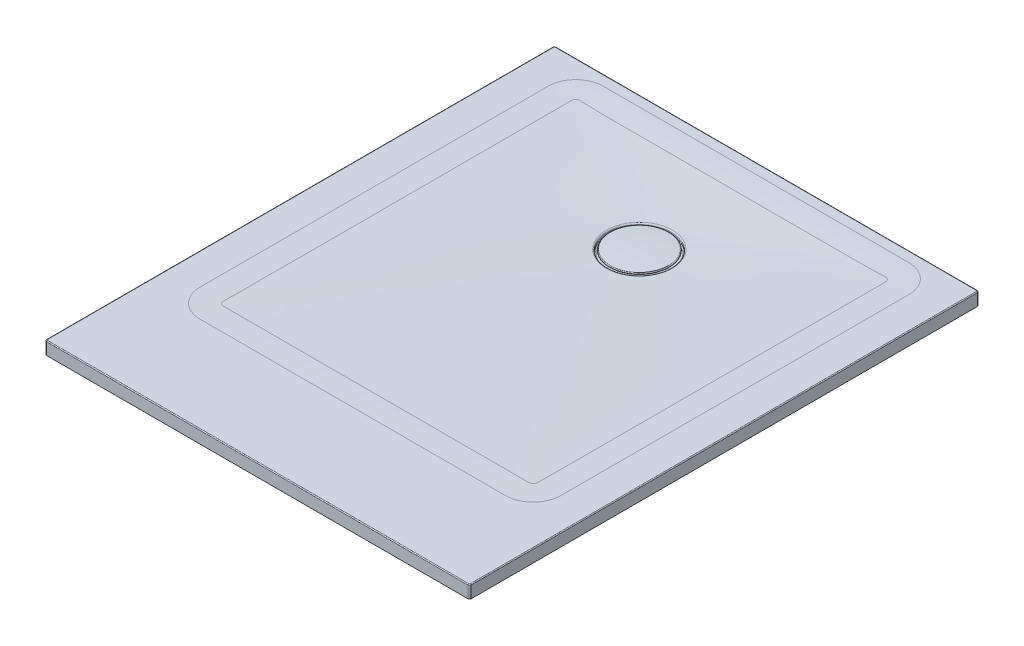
SolidWorks part; units mm, degrees
ref_plane "Płaszczyzna przednia" through (0, 0, 0) normal (0, 0, 1) x (1, 0, 0)
ref_plane "Płaszczyzna górna" through (0, 0, 0) normal (0, 1, 0) x (1, 0, 0)
ref_plane "Płaszczyzna prawa" through (0, 0, 0) normal (1, 0, 0) x (0, 0, -1)
sketch "Szkic2" plane through (0, 0, 0) normal (0, 1, 0) x (1, 0, 0)
  line L0 (0, 600) -> (0, 300) construction
  line L1 (-500, -600) -> (500, -600)
  line L2 (-500, -600) -> (-500, 600)
  line L3 (-500, 600) -> (500, 600)
  line L4 (500, -600) -> (500, 600)
  line L5 (-500, -600) -> (500, 600) construction
  line L6 (-500, 600) -> (500, -600) construction
  line L7 (-410, 560) -> (410, 560)
  line L8 (-410, 560) -> (-410, -360)
  line L9 (-410, -360) -> (410, -360)
  line L10 (410, 560) -> (410, -360)
  line L11 (-450, 600) -> (-450, -400) construction
  line L12 (-450, -400) -> (450, -400) construction
  line L13 (450, -400) -> (450, 600) construction
  circle A0 centre (0, 300) radius 75
  point P0 (0, 0)
  point P11 (0, 560)
  point P16 (0, -400)
  dimension "D9" = 150
  dimension "D1" = 1000
  dimension "D2" = 1200
  dimension "D3" = 40
  dimension "D4" = 90
  dimension "D5" = 40
  dimension "D6" = 50
  dimension "D7" = 1000
  dimension "D8" = 300
  dimension "D10" = 900
sketch "Szkic3" plane through (0, 0, 0) normal (0, 1, 0) x (1, 0, 0)
  line L0 (-500, -600) -> (-500, 600) construction
  line L1 (-500, -600) -> (500, -600) construction
  line L2 (500, -600) -> (500, 600) construction
  line L3 (-500, 600) -> (500, 600) construction
  line L4 (-410, 560) -> (-410, -360) construction
  line L5 (-410, 560) -> (410, 560) construction
  line L6 (410, 560) -> (410, -360) construction
  line L7 (-410, -360) -> (410, -360) construction
  line L8 (-500, -600) -> (-500, 600)
  line L9 (-500, -600) -> (500, -600)
  line L10 (500, -600) -> (500, 600)
  line L11 (-500, 600) -> (500, 600)
  line L12 (-410, 510) -> (-410, -310)
  line L13 (-360, 560) -> (360, 560)
  line L14 (410, 510) -> (410, -310)
  line L15 (-360, -360) -> (360, -360)
  arc A0 (410, 510) -> (360, 560) centre (360, 510) ccw
  arc A1 (-360, 560) -> (-410, 510) centre (-360, 510) ccw
  arc A2 (360, -360) -> (410, -310) centre (360, -310) ccw
  arc A3 (-360, -360) -> (-410, -310) centre (-360, -310) cw
  dimension "D1" = 50
surface "Powierzchnia-Płaszczyzna1" sketch "Szkic3"
sketch "Szkic4" plane through (0, 0, 0) normal (0, 1, 0) x (1, 0, 0)
  line L0 (-410, 560) -> (-410, -360) construction
  line L1 (-410, -360) -> (410, -360) construction
  line L2 (410, 560) -> (410, -360) construction
  line L3 (-410, 560) -> (410, 560) construction
  line L4 (-410, 560) -> (-410, -360)
  line L5 (-410, -360) -> (410, -360)
  line L6 (410, 560) -> (410, -360)
  line L7 (-410, 560) -> (410, 560)
ref_plane "korek" through (0, -15, 0) normal (0, 1, 0) x (-1, 0, 0)
sketch "Szkic5" plane through (0, -15, 0) normal (0, 1, 0) x (-1, 0, 0)
  circle A0 centre (0, -300) radius 75 construction
  circle A1 centre (0, -300) radius 75
surface "Powierzchnia-Wyciągnięcie po profilach2"
surface "Powierzchnia-Połącz1"
sketch "Szkic7" plane through (0, 0, 0) normal (0, 1, 0) x (1, 0, 0)
  line L27 (360, 520) -> (-360, 520)
  line L28 (-370, 510) -> (-370, -310)
  line L29 (-360, -320) -> (360, -320)
  line L30 (370, -310) -> (370, 510)
  line L31 (360, 520) -> (-360, 520)
  line L32 (-370, 510) -> (-370, -310)
  line L33 (-360, -320) -> (360, -320)
  line L34 (370, -310) -> (370, 510)
  line L35 (360, 575) -> (-360, 575)
  line L36 (-425, 510) -> (-425, -310)
  line L37 (-360, -375) -> (360, -375)
  line L38 (425, -310) -> (425, 510)
  line L39 (360, 575) -> (-360, 575)
  line L40 (-425, 510) -> (-425, -310)
  line L41 (-360, -375) -> (360, -375)
  line L42 (425, -310) -> (425, 510)
  arc A0 (370, -310) -> (360, -320) centre (360, -310) cw
  arc A1 (-370, -310) -> (-360, -320) centre (-360, -310) ccw
  arc A2 (370, 510) -> (360, 520) centre (360, 510) ccw
  arc A3 (-370, 510) -> (-360, 520) centre (-360, 510) cw
  spline S23 degree 3 poles (-585.8032, 215.9967) (99.6092, 377.1366) (378.3831, 469.0143) (369.7447, 512.2677) (369.6659, 512.5845) (369.4757, 513.2124) (369.3642, 513.5245) (368.9877, 514.4322) (368.6811, 515.0064) (368.1374, 515.8214) (367.9415, 516.0861) (367.5237, 516.5957) (367.3038, 516.8382) (366.6125, 517.53) (366.1096, 517.9439) (365.2905, 518.4922) (365.0067, 518.6626) (364.4299, 518.9712) (364.1354, 519.1107) (363.5342, 519.3603) (363.2276, 519.4705) (362.6023, 519.6611) (362.2819, 519.7414) (281.2653, 536.0283) (86.0111, -477.4271) (224.7205, 1510.8049) knots -8.278736 -8.278736 -8.278736 -8.278736 0.125 0.125 0.1875 0.1875 0.25 0.25 0.375 0.375 0.4375 0.4375 0.5 0.5 0.625 0.625 0.6875 0.6875 0.75 0.75 0.8125 0.8125 0.875 0.875 16.494923 16.494923 16.494923 16.494923 only from (370, 510) to (360, 520)
  spline S24 degree 3 poles (-62.6424, -434.7659) (-222.1147, 233.9635) (-317.8744, 528.6172) (-362.2677, 519.7446) (-362.5845, 519.6659) (-363.2124, 519.4757) (-363.5245, 519.364) (-364.4324, 518.988) (-365.0066, 518.681) (-365.8216, 518.1373) (-366.0864, 517.9413) (-366.596, 517.5235) (-366.8384, 517.3036) (-367.5302, 516.6122) (-367.9441, 516.1093) (-368.4924, 515.2902) (-368.6627, 515.0064) (-368.9714, 514.4296) (-369.1107, 514.135) (-369.3605, 513.5339) (-369.4706, 513.2273) (-369.6611, 512.6019) (-369.7416, 512.2817) (-387.02, 426.2571) (754.757, 211.7822) (-1358.5199, 358.9702) knots -8.502084 -8.502084 -8.502084 -8.502084 0.125 0.125 0.1875 0.1875 0.25 0.25 0.375 0.375 0.4375 0.4375 0.5 0.5 0.625 0.625 0.6875 0.6875 0.75 0.75 0.8125 0.8125 0.875 0.875 17.465974 17.465974 17.465974 17.465974 only from (-360, 520) to (-370, 510)
  spline S25 degree 3 poles (585.8036, -15.9966) (-99.6092, -177.1366) (-378.3831, -269.0143) (-369.7447, -312.2677) (-369.6659, -312.5845) (-369.4757, -313.2124) (-369.3642, -313.5245) (-368.9877, -314.4322) (-368.6811, -315.0064) (-368.1374, -315.8214) (-367.9415, -316.0861) (-367.5237, -316.5957) (-367.3038, -316.8382) (-366.6125, -317.53) (-366.1096, -317.9439) (-365.2905, -318.4922) (-365.0067, -318.6626) (-364.4299, -318.9712) (-364.1354, -319.1107) (-363.5342, -319.3603) (-363.2276, -319.4705) (-362.6023, -319.6611) (-362.2819, -319.7414) (-281.2653, -336.0283) (-86.0111, 677.4271) (-224.7205, -1310.8049) knots -8.278736 -8.278736 -8.278736 -8.278736 0.125 0.125 0.1875 0.1875 0.25 0.25 0.375 0.375 0.4375 0.4375 0.5 0.5 0.625 0.625 0.6875 0.6875 0.75 0.75 0.8125 0.8125 0.875 0.875 16.494923 16.494923 16.494923 16.494923 only from (-370, -310) to (-360, -320)
  spline S26 degree 3 poles (62.6425, 634.7656) (222.1147, -33.9635) (317.8744, -328.6172) (362.2677, -319.7446) (362.5845, -319.6659) (363.2124, -319.4757) (363.5245, -319.364) (364.4324, -318.988) (365.0066, -318.681) (365.8216, -318.1373) (366.0864, -317.9413) (366.596, -317.5235) (366.8384, -317.3036) (367.5302, -316.6122) (367.9441, -316.1093) (368.4924, -315.2902) (368.6627, -315.0064) (368.9714, -314.4296) (369.1107, -314.135) (369.3605, -313.5339) (369.4706, -313.2273) (369.6611, -312.6019) (369.7416, -312.2817) (387.02, -226.2571) (-754.757, -11.7822) (1358.5199, -158.9702) knots -8.502084 -8.502084 -8.502084 -8.502084 0.125 0.125 0.1875 0.1875 0.25 0.25 0.375 0.375 0.4375 0.4375 0.5 0.5 0.625 0.625 0.6875 0.6875 0.75 0.75 0.8125 0.8125 0.875 0.875 17.465974 17.465974 17.465974 17.465974 only from (360, -320) to (370, -310)
  spline S31 degree 3 poles (-2408.8136, -433.818) (-86.1423, 117.7027) (439.827, 363.1355) (424.4771, 518.4946) (424.1673, 520.5877) (423.3421, 524.739) (422.8283, 526.7974) (421.9014, 529.8584) (421.5658, 530.8759) (420.8441, 532.8946) (420.4597, 533.8908) (418.4224, 538.8083) (416.4282, 542.5403) (413.4835, 546.9546) (412.8717, 547.8249) (411.6019, 549.5396) (410.942, 550.3863) (408.9051, 552.8705) (407.476, 554.4468) (402.9824, 558.9436) (399.7134, 561.6343) (395.2772, 564.6046) (394.3697, 565.1803) (392.5352, 566.2815) (391.6078, 566.8074) (388.7956, 568.3124) (386.8811, 569.219) (382.9737, 570.8415) (380.9809, 571.5575) (377.9321, 572.4867) (376.9059, 572.7721) (374.8332, 573.2937) (373.7848, 573.5304) (370.636, 574.1601) (368.5249, 574.4735) (211.2135, 590.0332) (-5.3356, 52.9172) (-424.2777, -2306.4688) knots -4.476002 -4.476002 -4.476002 -4.476002 0.0625 0.0625 0.125 0.125 0.1875 0.1875 0.21875 0.21875 0.25 0.25 0.375 0.375 0.40625 0.40625 0.4375 0.4375 0.5 0.5 0.625 0.625 0.65625 0.65625 0.6875 0.6875 0.75 0.75 0.8125 0.8125 0.84375 0.84375 0.875 0.875 0.9375 0.9375 5.507189 5.507189 5.507189 5.507189 only from (425, 510) to (360, 575)
  spline S32 degree 3 poles (550.7247, -2270.8156) (-4.8641, 144.4921) (-224.6496, 588.6647) (-368.4946, 574.4771) (-370.5877, 574.1673) (-374.739, 573.342) (-376.7974, 572.8284) (-379.8584, 571.9015) (-380.8759, 571.5657) (-382.8945, 570.844) (-383.8908, 570.4596) (-388.8085, 568.4227) (-392.5404, 566.4282) (-396.9548, 563.4834) (-397.8251, 562.8716) (-399.5399, 561.6017) (-400.3866, 560.9418) (-402.8708, 558.9049) (-404.447, 557.4758) (-408.9438, 552.9822) (-411.6344, 549.7131) (-414.6047, 545.2769) (-415.1805, 544.3694) (-416.2817, 542.5349) (-416.8076, 541.6074) (-418.3126, 538.7953) (-419.219, 536.8807) (-420.8417, 532.9734) (-421.5576, 530.9805) (-422.4867, 527.9317) (-422.7721, 526.9055) (-423.2938, 524.8328) (-423.5305, 523.7845) (-424.1602, 520.6357) (-424.4735, 518.5247) (-441.8984, 342.6671) (240.4563, 91.2412) (2439.6808, -328.6409) knots -4.134891 -4.134891 -4.134891 -4.134891 0.0625 0.0625 0.125 0.125 0.1875 0.1875 0.21875 0.21875 0.25 0.25 0.375 0.375 0.40625 0.40625 0.4375 0.4375 0.5 0.5 0.625 0.625 0.65625 0.65625 0.6875 0.6875 0.75 0.75 0.8125 0.8125 0.84375 0.84375 0.875 0.875 0.9375 0.9375 6.053515 6.053515 6.053515 6.053515 only from (-360, 575) to (-425, 510)
  spline S33 degree 3 poles (2408.8138, 633.818) (86.1423, 82.2973) (-439.827, -163.1355) (-424.4771, -318.4946) (-424.1673, -320.5877) (-423.3421, -324.739) (-422.8283, -326.7974) (-421.9014, -329.8584) (-421.5658, -330.8759) (-420.8441, -332.8946) (-420.4597, -333.8908) (-418.4224, -338.8083) (-416.4282, -342.5403) (-413.4835, -346.9546) (-412.8717, -347.8249) (-411.6019, -349.5396) (-410.942, -350.3863) (-408.9051, -352.8705) (-407.476, -354.4468) (-402.9824, -358.9436) (-399.7134, -361.6343) (-395.2772, -364.6046) (-394.3697, -365.1803) (-392.5352, -366.2815) (-391.6078, -366.8074) (-388.7956, -368.3124) (-386.8811, -369.219) (-382.9737, -370.8415) (-380.9809, -371.5575) (-377.9321, -372.4867) (-376.9059, -372.7721) (-374.8332, -373.2937) (-373.7848, -373.5304) (-370.636, -374.1601) (-368.5249, -374.4735) (-211.2135, -390.0332) (5.3356, 147.0828) (424.2777, 2506.4688) knots -4.476002 -4.476002 -4.476002 -4.476002 0.0625 0.0625 0.125 0.125 0.1875 0.1875 0.21875 0.21875 0.25 0.25 0.375 0.375 0.40625 0.40625 0.4375 0.4375 0.5 0.5 0.625 0.625 0.65625 0.65625 0.6875 0.6875 0.75 0.75 0.8125 0.8125 0.84375 0.84375 0.875 0.875 0.9375 0.9375 5.507189 5.507189 5.507189 5.507189 only from (-425, -310) to (-360, -375)
  spline S34 degree 3 poles (-550.7247, 2470.8156) (4.8641, 55.5079) (224.6496, -388.6647) (368.4946, -374.4771) (370.5877, -374.1673) (374.739, -373.342) (376.7974, -372.8284) (379.8584, -371.9015) (380.8759, -371.5657) (382.8945, -370.844) (383.8908, -370.4596) (388.8085, -368.4227) (392.5404, -366.4282) (396.9548, -363.4834) (397.8251, -362.8716) (399.5399, -361.6017) (400.3866, -360.9418) (402.8708, -358.9049) (404.447, -357.4758) (408.9438, -352.9822) (411.6344, -349.7131) (414.6047, -345.2769) (415.1805, -344.3694) (416.2817, -342.5349) (416.8076, -341.6074) (418.3126, -338.7953) (419.219, -336.8807) (420.8417, -332.9734) (421.5576, -330.9805) (422.4867, -327.9317) (422.7721, -326.9055) (423.2938, -324.8328) (423.5305, -323.7845) (424.1602, -320.6357) (424.4735, -318.5247) (441.8984, -142.6671) (-240.4563, 108.7588) (-2439.6808, 528.6409) knots -4.134891 -4.134891 -4.134891 -4.134891 0.0625 0.0625 0.125 0.125 0.1875 0.1875 0.21875 0.21875 0.25 0.25 0.375 0.375 0.40625 0.40625 0.4375 0.4375 0.5 0.5 0.625 0.625 0.65625 0.65625 0.6875 0.6875 0.75 0.75 0.8125 0.8125 0.84375 0.84375 0.875 0.875 0.9375 0.9375 6.053515 6.053515 6.053515 6.053515 only from (360, -375) to (425, -310)
  spline S35 degree 3 poles (425, 510) (425, 512.1459) (424.8941, 514.2738) (424.4771, 518.4946) (424.1673, 520.5877) (423.3421, 524.739) (422.8283, 526.7974) (421.9014, 529.8584) (421.5658, 530.8759) (420.8441, 532.8946) (420.4597, 533.8908) (418.4224, 538.8083) (416.4282, 542.5403) (413.4835, 546.9546) (412.8717, 547.8249) (411.6019, 549.5396) (410.942, 550.3863) (408.9051, 552.8705) (407.476, 554.4468) (402.9824, 558.9436) (399.7134, 561.6343) (395.2772, 564.6046) (394.3697, 565.1803) (392.5352, 566.2815) (391.6078, 566.8074) (388.7956, 568.3124) (386.8811, 569.219) (382.9737, 570.8415) (380.9809, 571.5575) (377.9321, 572.4867) (376.9059, 572.7721) (374.8332, 573.2937) (373.7848, 573.5304) (370.636, 574.1601) (368.5249, 574.4735) (364.2799, 574.8934) (362.1458, 575) (360, 575) knots 0 0 0 0 0.0625 0.0625 0.125 0.125 0.1875 0.1875 0.21875 0.21875 0.25 0.25 0.375 0.375 0.40625 0.40625 0.4375 0.4375 0.5 0.5 0.625 0.625 0.65625 0.65625 0.6875 0.6875 0.75 0.75 0.8125 0.8125 0.84375 0.84375 0.875 0.875 0.9375 0.9375 1 1 1 1
  spline S36 degree 3 poles (-360, 575) (-362.1459, 575) (-364.2737, 574.8934) (-368.4946, 574.4771) (-370.5877, 574.1673) (-374.739, 573.342) (-376.7974, 572.8284) (-379.8584, 571.9015) (-380.8759, 571.5657) (-382.8945, 570.844) (-383.8908, 570.4596) (-388.8085, 568.4227) (-392.5404, 566.4282) (-396.9548, 563.4834) (-397.8251, 562.8716) (-399.5399, 561.6017) (-400.3866, 560.9418) (-402.8708, 558.9049) (-404.447, 557.4758) (-408.9438, 552.9822) (-411.6344, 549.7131) (-414.6047, 545.2769) (-415.1805, 544.3694) (-416.2817, 542.5349) (-416.8076, 541.6074) (-418.3126, 538.7953) (-419.219, 536.8807) (-420.8417, 532.9734) (-421.5576, 530.9805) (-422.4867, 527.9317) (-422.7721, 526.9055) (-423.2938, 524.8328) (-423.5305, 523.7845) (-424.1602, 520.6357) (-424.4735, 518.5247) (-424.8941, 514.2798) (-425, 512.1458) (-425, 510) knots 0 0 0 0 0.0625 0.0625 0.125 0.125 0.1875 0.1875 0.21875 0.21875 0.25 0.25 0.375 0.375 0.40625 0.40625 0.4375 0.4375 0.5 0.5 0.625 0.625 0.65625 0.65625 0.6875 0.6875 0.75 0.75 0.8125 0.8125 0.84375 0.84375 0.875 0.875 0.9375 0.9375 1 1 1 1
  spline S37 degree 3 poles (-425, -310) (-425, -312.1459) (-424.8941, -314.2738) (-424.4771, -318.4946) (-424.1673, -320.5877) (-423.3421, -324.739) (-422.8283, -326.7974) (-421.9014, -329.8584) (-421.5658, -330.8759) (-420.8441, -332.8946) (-420.4597, -333.8908) (-418.4224, -338.8083) (-416.4282, -342.5403) (-413.4835, -346.9546) (-412.8717, -347.8249) (-411.6019, -349.5396) (-410.942, -350.3863) (-408.9051, -352.8705) (-407.476, -354.4468) (-402.9824, -358.9436) (-399.7134, -361.6343) (-395.2772, -364.6046) (-394.3697, -365.1803) (-392.5352, -366.2815) (-391.6078, -366.8074) (-388.7956, -368.3124) (-386.8811, -369.219) (-382.9737, -370.8415) (-380.9809, -371.5575) (-377.9321, -372.4867) (-376.9059, -372.7721) (-374.8332, -373.2937) (-373.7848, -373.5304) (-370.636, -374.1601) (-368.5249, -374.4735) (-364.2799, -374.8934) (-362.1458, -375) (-360, -375) knots 0 0 0 0 0.0625 0.0625 0.125 0.125 0.1875 0.1875 0.21875 0.21875 0.25 0.25 0.375 0.375 0.40625 0.40625 0.4375 0.4375 0.5 0.5 0.625 0.625 0.65625 0.65625 0.6875 0.6875 0.75 0.75 0.8125 0.8125 0.84375 0.84375 0.875 0.875 0.9375 0.9375 1 1 1 1
  spline S38 degree 3 poles (360, -375) (362.1459, -375) (364.2737, -374.8934) (368.4946, -374.4771) (370.5877, -374.1673) (374.739, -373.342) (376.7974, -372.8284) (379.8584, -371.9015) (380.8759, -371.5657) (382.8945, -370.844) (383.8908, -370.4596) (388.8085, -368.4227) (392.5404, -366.4282) (396.9548, -363.4834) (397.8251, -362.8716) (399.5399, -361.6017) (400.3866, -360.9418) (402.8708, -358.9049) (404.447, -357.4758) (408.9438, -352.9822) (411.6344, -349.7131) (414.6047, -345.2769) (415.1805, -344.3694) (416.2817, -342.5349) (416.8076, -341.6074) (418.3126, -338.7953) (419.219, -336.8807) (420.8417, -332.9734) (421.5576, -330.9805) (422.4867, -327.9317) (422.7721, -326.9055) (423.2938, -324.8328) (423.5305, -323.7845) (424.1602, -320.6357) (424.4735, -318.5247) (424.8941, -314.2798) (425, -312.1458) (425, -310) knots 0 0 0 0 0.0625 0.0625 0.125 0.125 0.1875 0.1875 0.21875 0.21875 0.25 0.25 0.375 0.375 0.40625 0.40625 0.4375 0.4375 0.5 0.5 0.625 0.625 0.65625 0.65625 0.6875 0.6875 0.75 0.75 0.8125 0.8125 0.84375 0.84375 0.875 0.875 0.9375 0.9375 1 1 1 1
  dimension "D3" = 10
  dimension "D1" = 40
  dimension "D2" = 15
other "Usuń ścianę1"
other "Granica-Powierzchnia1"
surface "Powierzchnia-Połącz2"
sketch "Szkic9" plane through (0, 0, 0) normal (0, 1, 0) x (1, 0, 0)
  line L0 (-500, -600) -> (500, -600) construction
  line L1 (-500, -600) -> (-500, 600) construction
  line L2 (500, -600) -> (500, 600) construction
  line L3 (-500, 600) -> (500, 600) construction
  line L4 (-500, -600) -> (500, -600)
  line L5 (-500, -600) -> (-500, 600)
  line L6 (500, -600) -> (500, 600)
  line L7 (-500, 600) -> (500, 600)
surface "Powierzchnia-Wyciągnięcie1" sketch "Szkic9" parameters "D1"=30
sketch "Szkic8" plane through (0, 0, 0) normal (1, 0, 0) x (0, 0, -1)
  line L0 (300, 0) -> (300, -30) construction
  line L1 (224.9999, -15) -> (225.2968, -23.5)
  line L4 (225.2968, -23.5) -> (248, -24.0945)
  line L5 (225.2968, -23.5) -> (300, -23.5) construction
  line L6 (248, -24.0945) -> (248, -30) construction
  line L7 (300, -30) -> (225.2968, -30) construction
  line L8 (225.2968, -30) -> (225.2968, -23.5) construction
  line L9 (255, -28) -> (255, -30)
  line L10 (248, -24.0945) -> (255, -28)
  dimension "D1" = 30
  dimension "D2" = 8.5
  dimension "D3" = 2
  dimension "D4" = 1.5
  dimension "D5" = 52
  dimension "D6" = 45
  dimension "D7" = 2
surface "Powierzchnia-Obrót1" sketch "Szkic8" parameters "D1"=360
surface "Powierzchnia-Płaszczyzna2"
surface "Powierzchnia-Połącz3"
fillet "Zaokrąglenie4" radius 4 4 edges at (-500, -15, -600) (500, -15, -600) (-500, -15, 600) (500, -15, 600)
fillet "Zaokrąglenie5" radius 3 3 edges at (0, -24.0945, -352) (0, -23.5, -374.7032)
fillet "Zaokrąglenie6" radius 2 9 edges at (498.8284, 0, 598.8284) (0, 0, 600) (-498.8284, 0, 598.8284) (-500, 0, 0) (-498.8284, 0, -598.8284) (0, 0, -600) (498.8284, 0, -598.8284) (500, 0, 0) (0, -28, -345)
sketch "Szkic11" plane through (0, 0, 0) normal (1, 0, 0) x (0, 0, -1)
  line L0 (300, 0) -> (300, -30) construction
  line L1 (-596, -30) -> (596, -30) construction
  line L2 (300, -17) -> (300, -11.5)
  line L14 (370, -11.5) -> (370, -14.5) construction
  line L16 (370, -17) -> (300, -17)
  line L18 (370, -17) -> (370, -16.3377)
  line L19 (300, -11.5) -> (370, -11.5) construction
  arc A0 (370, -16.3377) -> (368.1666, -14.3446) centre (368, -16.3377) ccw
  arc A6 (368.1666, -14.3446) -> (300, -11.5) centre (300, -829.6667) ccw
  dimension "D2" = 2
  dimension "D8" = 2.5
  dimension "D9" = 17
  dimension "D10" = 5.5
  dimension "D11" = 70
revolve "Obrót1" add sketch "Szkic11" angle 360 about L0
